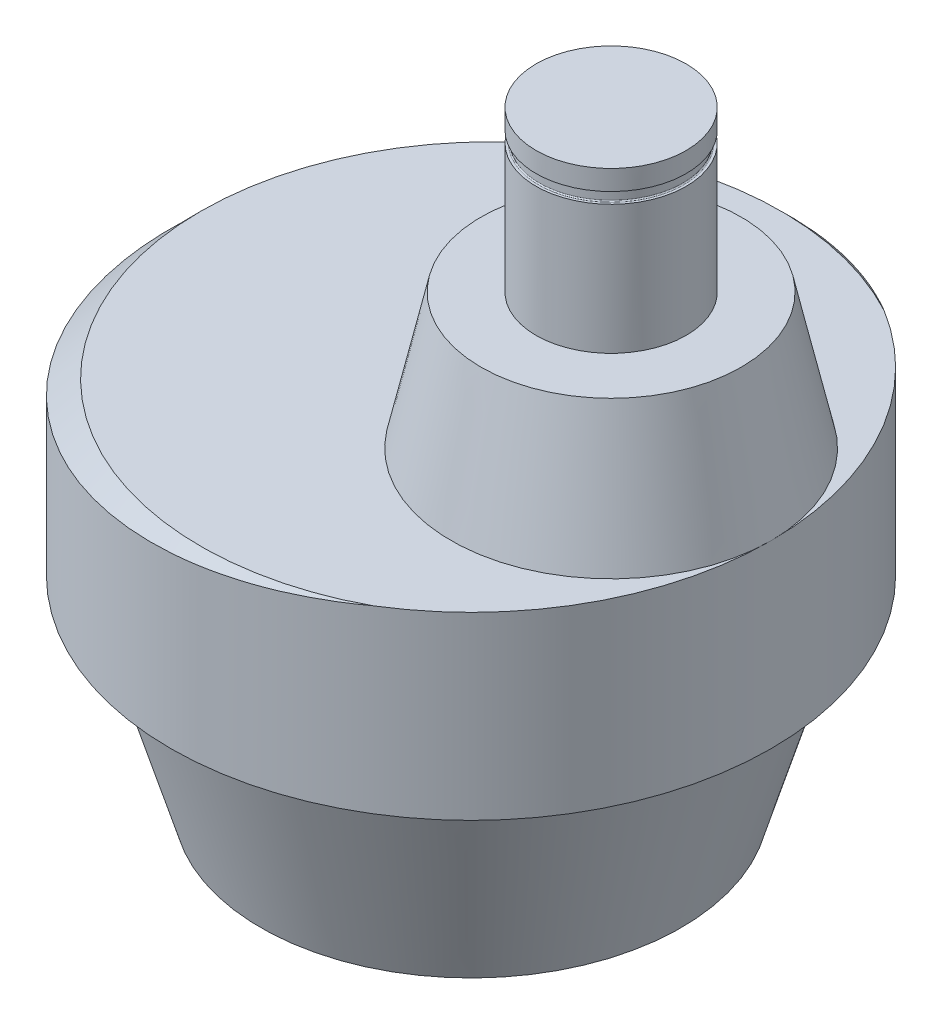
SolidWorks part; units mm, degrees
ref_plane "Plan de face" through (0, 0, 0) normal (0, 0, 1) x (1, 0, 0)
ref_plane "Plan de dessus" through (0, 0, 0) normal (0, 1, 0) x (1, 0, 0)
ref_plane "Plan de droite" through (0, 0, 0) normal (1, 0, 0) x (0, 0, -1)
sketch "Esquisse1" plane through (0, 0, 0) normal (0, 0, 1) x (1, 0, 0)
  line L0 (0, 38) -> (30, 38)
  line L1 (0, -11.5819) -> (0, 86.2441) construction
  line L2 (30, 38) -> (30, 20)
  line L3 (30, 20) -> (29.2321, 20)
  line L4 (26.3586, 17.862) -> (21, 0)
  line L5 (21, 0) -> (0, 0)
  line L8 (0, 0) -> (0, 38)
  arc A0 (29.2321, 20) -> (26.3586, 17.862) centre (29.2321, 17) ccw
  point P13 (27, 20)
  dimension "D8" = 3
  dimension "D1" = 60
  dimension "D2" = 18
  dimension "D3" = 38
  dimension "D4" = 42
  dimension "D5" = 54
revolve "Révolution1" add sketch "Esquisse1" angle 360 about L1
sketch "Esquisse2" plane through (0, 38, 0) normal (0, 1, 0) x (-1, 0, 0)
  line L0 (0, 0) -> (0, -34.2337) construction
  line L1 (15.4552, 0) -> (-42.6723, 0) construction
  circle A0 centre (-14, 0) radius 16
  dimension "D1" = 32
  dimension "D2" = 14
ref_plane "Plan1" through (0, 51.5, 0) normal (0, 1, 0) x (-1, 0, 0)
sketch "Esquisse3" plane through (0, 51.5, 0) normal (0, 1, 0) x (-1, 0, 0)
  circle A0 centre (-14, 0) radius 13
  dimension "D1" = 26
loft "Lissage1" add profiles "Esquisse3", "Esquisse2"
sketch "Esquisse4" plane through (0, 51.5, 0) normal (0, 1, 0) x (-1, 0, 0)
  circle A0 centre (-14, 0) radius 7.5
  circle A1 centre (-14, 0) radius 13 construction
  dimension "D1" = 15
extrude "Extrusion1" add sketch "Esquisse4" along normal blind 16
sketch "Esquisse10" plane through (0, 0, 0) normal (0, 0, 1) x (1, 0, 0)
  line L0 (2, 82.4057) -> (2, -16.9473) construction
  line L1 (0, -11.5819) -> (0, 86.2441) construction
  dimension "D1" = 2
sketch "Esquisse9" plane through (0, 0, 0) normal (0, 0, 1) x (1, 0, 0)
  line L0 (-30, 38) -> (-27, 38)
  line L1 (30, 38) -> (-30, 38) construction
  line L2 (-27, 38) -> (-30, 35)
  line L4 (-30, 35) -> (-30, 38)
  line L5 (30, 38) -> (-30, 38) construction
  line L6 (-30, 38) -> (-30, 20) construction
  dimension "D1" = 3
  dimension "D2" = 45
revolve "Enlèvement de matière-Révolution3" cut sketch "Esquisse9" angle 360 about L0
ref_plane "Plan2" through (20, 67.5, 0) normal (-1, 0, 0) x (0, 0, -1)
hole_wizard "Diamètre du perçage Ø0.15 (0.15)1" positions "Esquisse15" profile "Esquisse14" hole size "Ø0.15" standard "ISO"
sketch "Esquisse15" plane through (0, 0, 0) normal (0, -1, 0) x (1, 0, 0)
  point P0 (0, 0)
sketch "Esquisse14" plane through (0, 0, 0) normal (1, 0, 0) x (0, 0, -1)
  line L0 (0, 0) -> (0, 37.8112)
  line L1 (0, 37.8112) -> (13, 30)
  line L2 (13, 30) -> (13, 0)
  line L5 (13, 0) -> (0, 0)
  line L10 (0, 37.8112) -> (-13, 30) construction
  line L11 (0, -6.35) -> (0, 107.95) construction
  dimension "Diamètre du perçage" = 26
  dimension "Profondeur du perçage" = 30
  dimension "Angle de pointe" = 118
ref_plane "Plan3" through (14, 0, 0) normal (1, 0, 0) x (0, 0, -1)
sketch "Esquisse13" plane through (14, 67.5, 0) normal (-1, 0, 0) x (0, 0, -1)
  line L0 (7.26, 2) -> (7.5, 2)
  line L1 (7.5, 2) -> (7.5, 3.1)
  line L2 (7.5, 3.1) -> (7.26, 3.1)
  line L3 (7.15, 2.99) -> (7.15, 2.11)
  line L4 (0, -50.059) -> (0, 49.9386) construction
  line L9 (-13, 16) -> (13, 16) construction
  line L10 (7.5, 0) -> (7.5, 16) construction
  line L12 (0, 79.0819) -> (0, -18.7441) construction
  arc A0 (7.15, 2.11) -> (7.26, 2) centre (7.26, 2.11) ccw
  arc A1 (7.15, 2.99) -> (7.26, 3.1) centre (7.26, 2.99) cw
  dimension "D1" = 0.11
  dimension "D2" = 0.11
  dimension "D3" = 14.3
  dimension "D4" = 14
  dimension "D5" = 1.1
revolve "Gorge pour DIN 471 - 15 x 1, Circlips extérieur - normal1" cut sketch "Esquisse13"
